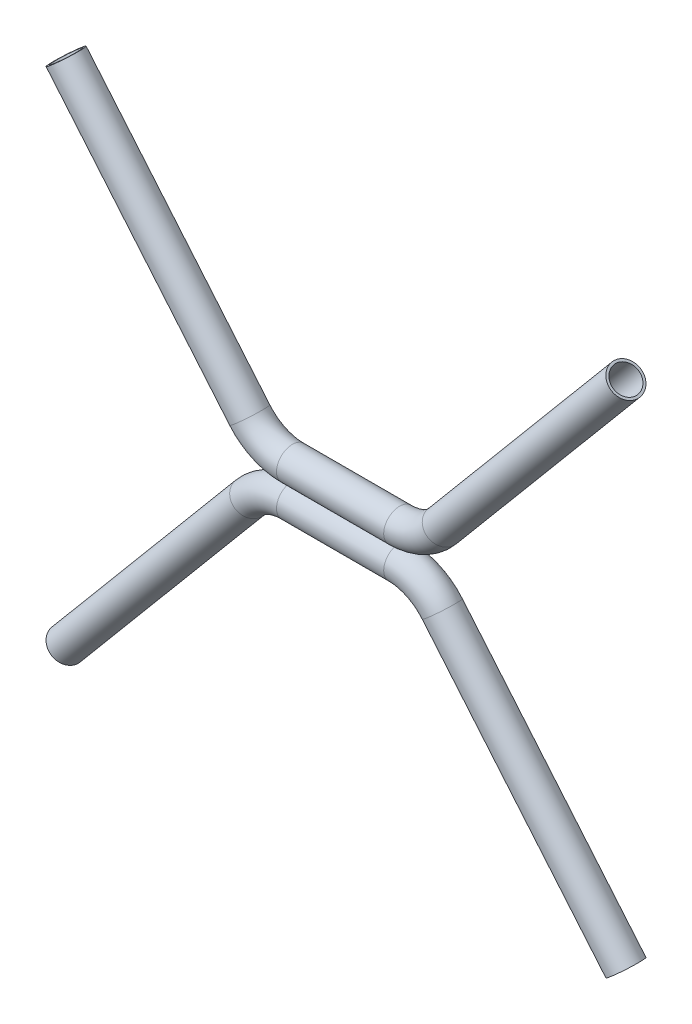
SolidWorks part; units mm, degrees
other "Detailelement1"
ref_plane "Ebene vorne" through (0, 0, 0) normal (0, 0, 1) x (1, 0, 0)
ref_plane "Ebene oben" through (0, 0, 0) normal (0, 1, 0) x (1, 0, 0)
ref_plane "Ebene rechts" through (0, 0, 0) normal (1, 0, 0) x (0, 0, -1)
sketch "Skizze1" plane through (0, 0, 0) normal (0, 0, 1) x (1, 0, 0)
  line L1 (0, 0) -> (-33.6792, 0)
  line L2 (-60.4908, -12.5024) -> (-175.8649, -150)
  line L3 (0, 34.0258) -> (0, -80.3148) construction
  arc A0 (-33.6792, 0) -> (-60.4908, -12.5024) centre (-33.6792, -35) ccw
  point P10 (-50, 0)
  point P13 (50, 0)
  dimension "D6" = 35
  dimension "D1" = 50
  dimension "D2" = 50
  dimension "D4" = 150
sketch "Skizze2" plane through (0, 0, 0) normal (1, 0, 0) x (0, 0, -1)
  circle A0 centre (0, 0) radius 10
  circle A1 centre (0, 0) radius 8.5
  dimension "D1" = 20
  dimension "D2" = 1.5
sweep "Austragung3" add profiles "Skizze2" path "Skizze1"
mirror "Spiegeln2" about plane through (0, 0, 0) normal (1, 0, 0) of "Austragung3"
ref_plane "Ebene1" through (0, 10, 0) normal (0, 1, 0) x (-1, 0, 0)
mirror "Spiegeln3" about plane through (0, 10, 0) normal (0, 1, 0)
other "Kehlnaht1" parameters "D10"=6, "D11"=40, "D12"=20, "D13"=3, "D14"=3
